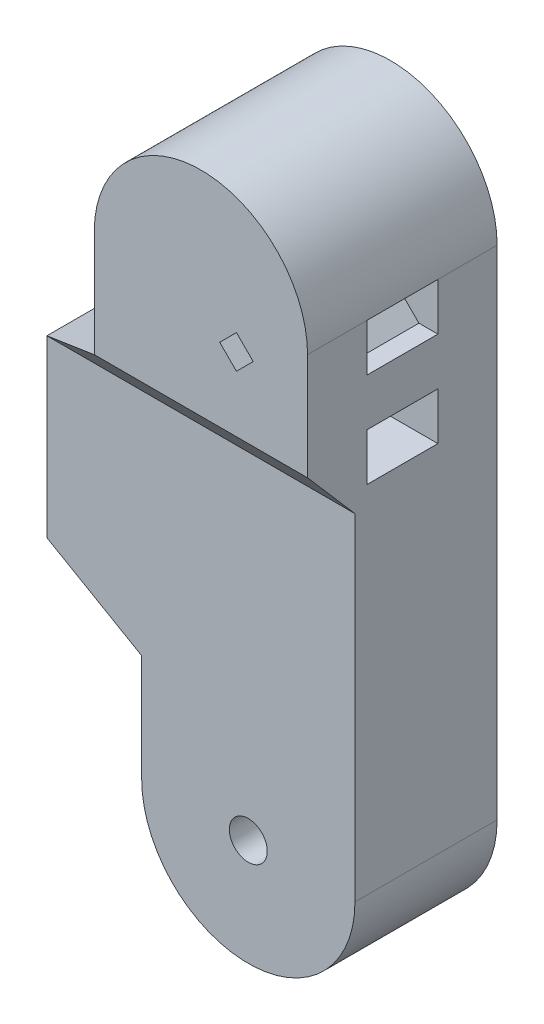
SolidWorks part; units mm, degrees
ref_plane "前视基准面" through (0, 0, 0) normal (0, 0, 1) x (1, 0, 0)
ref_plane "上视基准面" through (0, 0, 0) normal (0, 1, 0) x (1, 0, 0)
ref_plane "右视基准面" through (0, 0, 0) normal (1, 0, 0) x (0, 0, -1)
sketch "草图1" plane through (0, 0, 0) normal (0, 0, 1) x (1, 0, 0)
  line L0 (0, -52.5) -> (0, 52.5) construction
  line L1 (-22.5, -52.5) -> (-22.5, 52.5)
  line L2 (22.5, -52.5) -> (22.5, 52.5)
  line L3 (-22.5, 30) -> (-42.5, 18.453)
  line L4 (-42.5, 18.453) -> (-42.5, -18.453)
  line L5 (0, 0) -> (-42.5, 0) construction
  line L6 (-22.5, -30) -> (-42.5, -18.453)
  arc A0 (-22.5, -52.5) -> (22.5, -52.5) centre (0, -52.5) ccw
  arc A1 (22.5, 52.5) -> (-22.5, 52.5) centre (0, 52.5) ccw
  point P2 (0, 0)
  dimension "D2" = 22.5
  dimension "D1" = 105
  dimension "D3" = 60
  dimension "D4" = 30
  dimension "D5" = 20
extrude "凸台-拉伸1" add sketch "草图1" along normal mid plane 40 contours L2 A1 L1 A0 | L6 L1 L3 L4
sketch "草图2" plane through (-42.5, 0, 0) normal (-1, 0, 0) x (0, 0, 1)
  line L1 (10, -75) -> (10, 18.453)
  line L7 (-20, -75) -> (20, -75) construction
  line L11 (20, 18.453) -> (20, -75)
  line L12 (20, -75) -> (10, -75)
  line L18 (10, 18.453) -> (20, 30)
  line L19 (20, 30) -> (20, 18.453)
  dimension "D3" = 10
extrude "切除-拉伸1" cut sketch "草图2" against normal through all
sketch "草图3" plane through (0, 0, 0) normal (0, 0, 1) x (1, 0, 0)
  line L0 (22.5, 52.5) -> (-9.5, 52.5)
  line L1 (-9.5, 52.5) -> (-2.5, 45.5)
  line L2 (-2.5, 45.5) -> (3.9645, 45.5)
  line L3 (3.9645, 45.5) -> (7.5, 49.0355)
  line L4 (7.5, 49.0355) -> (11.0355, 45.5)
  line L5 (11.0355, 45.5) -> (15.5, 45.5)
  line L6 (15.5, 45.5) -> (18.5, 42.5)
  line L7 (18.5, 42.5) -> (22.5, 42.5)
  line L8 (22.5, 30) -> (22.5, 52.5) construction
  line L9 (22.5, 42.5) -> (22.5, 52.5)
  line L10 (22.5, 37.5) -> (-10.3317, 37.5) construction
  line L11 (22.5, 32.5) -> (22.5, 22.5)
  line L12 (18.5, 32.5) -> (22.5, 32.5)
  line L13 (15.5, 29.5) -> (18.5, 32.5)
  line L14 (11.0355, 29.5) -> (15.5, 29.5)
  line L15 (7.5, 25.9645) -> (11.0355, 29.5)
  line L16 (3.9645, 29.5) -> (7.5, 25.9645)
  line L17 (-2.5, 29.5) -> (3.9645, 29.5)
  line L18 (-9.5, 22.5) -> (-2.5, 29.5)
  line L19 (22.5, 22.5) -> (-9.5, 22.5)
  dimension "D1" = 10
  dimension "D2" = 7
  dimension "D3" = 7
  dimension "D4" = 5
  dimension "D5" = 5
  dimension "D6" = 4
  dimension "D7" = 32
  dimension "D8" = 15
  dimension "D9" = 135
  dimension "D10" = 15
extrude "切除-拉伸2" cut sketch "草图3" against normal mid plane 15
sketch "草图4" plane through (0, 0, 20) normal (0, 0, 1) x (1, 0, 0)
  line L0 (3.9645, 45.5) -> (7.5, 41.9645)
  line L1 (7.5, 41.9645) -> (11.0355, 45.5)
  line L2 (11.0355, 45.5) -> (7.5, 49.0355)
  line L3 (7.5, 49.0355) -> (3.9645, 45.5)
  dimension "D1" = 5
extrude "切除-拉伸3" cut sketch "草图4" against normal through all both and the other way through all
sketch "草图8" plane through (0, 0, -20) normal (0, 0, -1) x (-1, 0, 0)
  circle A0 centre (0, -52.5) radius 4
  dimension "D1" = 8
extrude "切除-拉伸4" cut sketch "草图8" against normal through all
